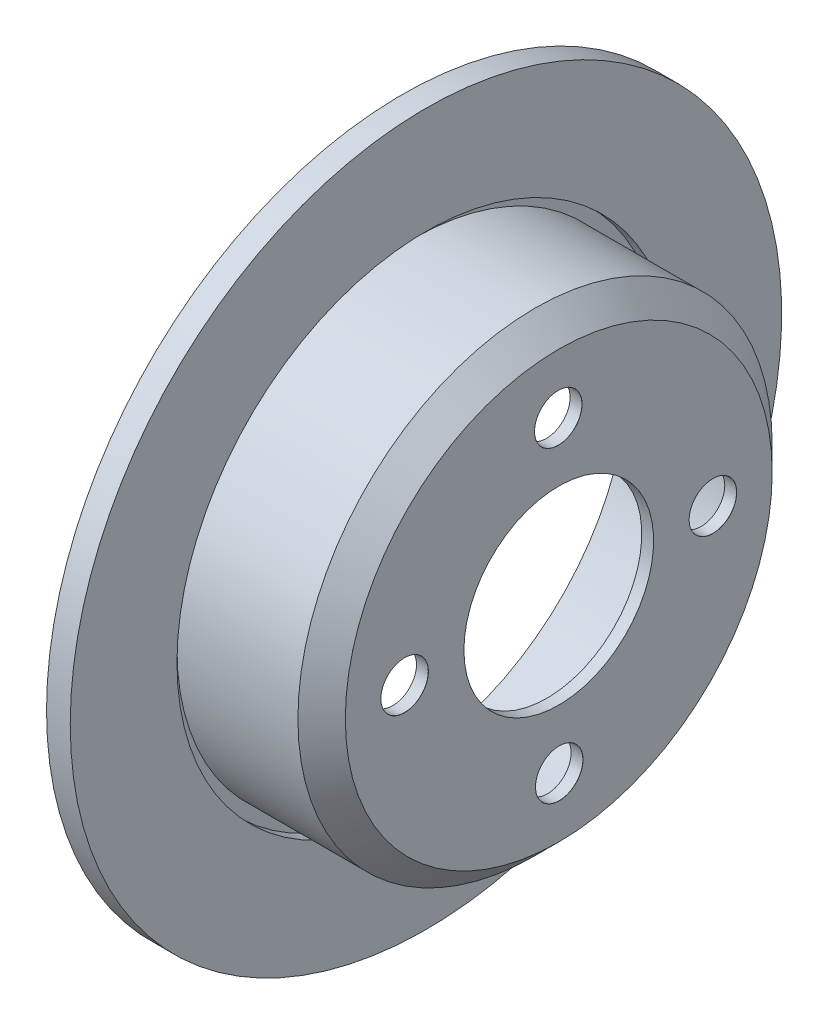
SolidWorks part; units mm, degrees
ref_plane "Front Plane" through (0, 0, 0) normal (0, 0, 1) x (1, 0, 0)
ref_plane "Top Plane" through (0, 0, 0) normal (0, 1, 0) x (1, 0, 0)
ref_plane "Right Plane" through (0, 0, 0) normal (1, 0, 0) x (0, 0, -1)
sketch "Sketch1" plane through (0, 0, 0) normal (0, 0, 1) x (1, 0, 0)
  line L0 (0, 40) -> (0, 90)
  line L1 (0, 90) -> (-10, 100)
  line L2 (-10, 100) -> (-61, 100)
  line L3 (-56, 105) -> (-56, 150)
  line L4 (-56, 150) -> (-66, 150)
  line L5 (-66, 150) -> (-66, 95)
  line L10 (-56, 105) -> (-61, 105)
  line L11 (-61, 105) -> (-61, 100)
  line L13 (0, 0) -> (3.2215, 0) construction
  line L14 (0, 90) -> (0.6936, 90) construction
  line L15 (-5, 40) -> (-5, 87.9289)
  line L16 (-5, 87.9289) -> (-12.0711, 95)
  line L17 (-12.0711, 95) -> (-66, 95)
  line L18 (-12.0711, 95) -> (-61, 95) construction
  line L19 (-5, 40) -> (0, 40)
  point P4 (-2.5, 40)
  point P18 (-61, 102.5)
  point P19 (0, 0)
  point P20 (0, 0)
  point P21 (0, 0)
  dimension "D1" = 5
  dimension "D2" = 300
  dimension "D3" = 200
  dimension "D4" = 66
  dimension "D5" = 10
  dimension "D6" = 5
  dimension "D7" = 45
  dimension "D8" = 80
  dimension "D9" = 90
  dimension "D10" = 5
revolve "Revolve1" add sketch "Sketch1" angle 360 about L13
sketch "Sketch2" plane through (0, 0, 0) normal (1, 0, 0) x (0, 0, -1)
  circle A0 centre (0, 0) radius 65 construction
  dimension "D1" = 130
hole_wizard "Ø20.0mm Dowel Hole1" positions "3DSketch1" profile "Sketch3" hole size "Ø20.0" standard "ANSI Metric"
sketch3d "3DSketch1"
  circle A0 centre (0, 0, 0) radius 65 construction
  point P0 (0, 0.2044, -64.9997)
  point P4 (65, 0, 0)
  point P7 (0, 0, 0)
sketch "Sketch3" plane through (0, 0.2044, -64.9997) normal (0, 1, 0) x (0, 0, -1)
  line L0 (0, 0) -> (0, 66)
  line L1 (0, 66) -> (10, 66)
  line L2 (10, 66) -> (10, 0.025)
  line L3 (10, 0.025) -> (10.025, 0)
  line L5 (10.025, 0) -> (0, 0)
  line L6 (-10, 0.025) -> (-10.025, 0) construction
  line L11 (0, -6.35) -> (0, 107.95) construction
  dimension "Thru Hole Dia." = 20
  dimension "Thru Hole Depth" = 66
  dimension "Near C'Sink Dia." = 20.05
  dimension "Near C'Sink Angle" = 90
pattern_circular "CirPattern1" count 4 over 360 about axis through (0, 0, 0) along (1, 0, 0) of "Ø20.0mm Dowel Hole1"
